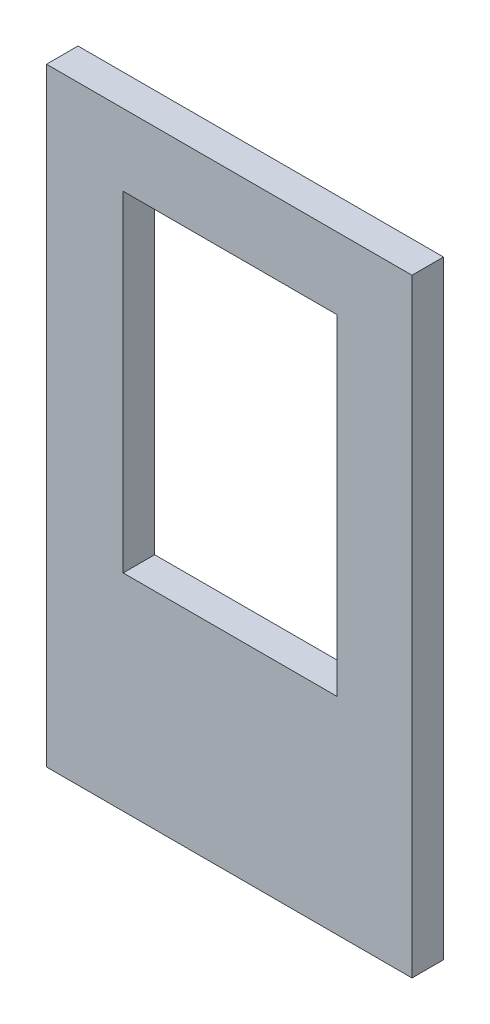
SolidWorks part; units mm, degrees
ref_plane "Plan de face" through (0, 0, 0) normal (0, 0, 1) x (1, 0, 0)
ref_plane "Plan de dessus" through (0, 0, 0) normal (0, 1, 0) x (1, 0, 0)
ref_plane "Plan de droite" through (0, 0, 0) normal (1, 0, 0) x (0, 0, -1)
sketch "Esquisse1" plane through (0, 0, 0) normal (0, 0, 1) x (1, 0, 0)
  line L1 (-59.15, 98.5) -> (59.15, 98.5)
  line L2 (-59.15, 98.5) -> (-59.15, -98.5)
  line L3 (-59.15, -98.5) -> (59.15, -98.5)
  line L4 (59.15, 98.5) -> (59.15, -98.5)
  line L5 (-59.15, 98.5) -> (59.15, -98.5) construction
  line L6 (-59.15, -98.5) -> (59.15, 98.5) construction
  point P0 (0, 0)
  dimension "D1" = 118.3
  dimension "D2" = 197
extrude "Boss.-Extru.1" add sketch "Esquisse1" along normal mid plane 10.2
extrude "Enlèv. mat.-Extru.1" cut sketch "Esquisse2" against normal through all
sketch "Esquisse2" plane through (-353.65, -41.0365, -24.1) normal (0, 0, -1) x (-1, 0, 0)
  line L1 (-388.6, 116.3365) -> (-319.3, 116.3365)
  line L2 (-388.6, 116.3365) -> (-388.6, 9.3365)
  line L3 (-388.6, 9.3365) -> (-319.3, 9.3365)
  line L4 (-319.3, 116.3365) -> (-319.3, 9.3365)
